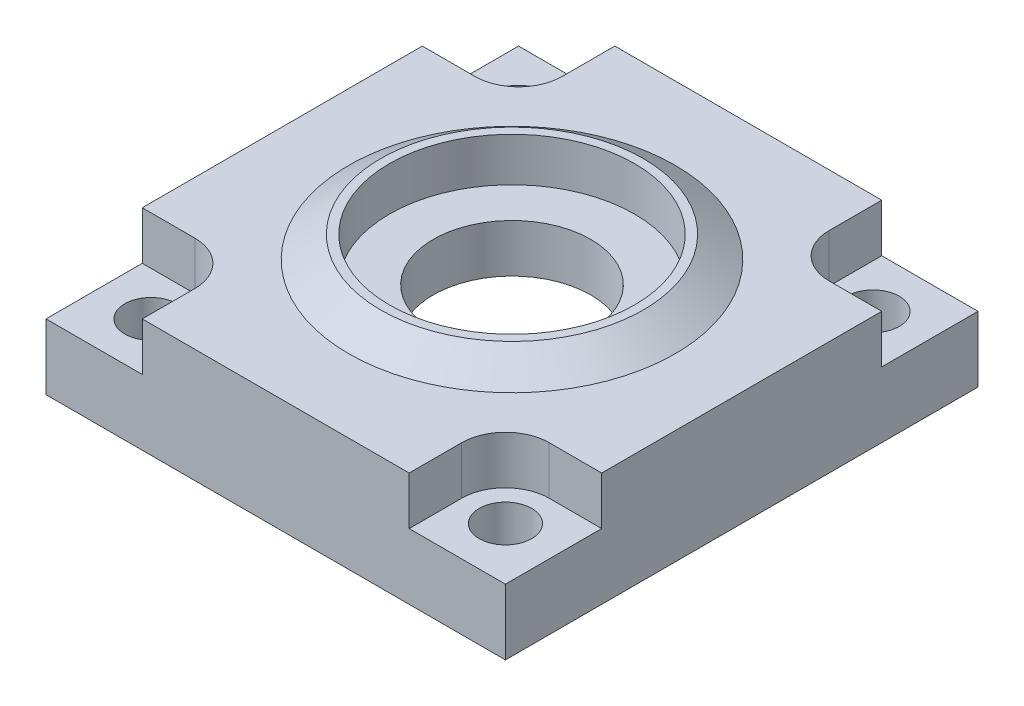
SolidWorks part; units mm, degrees
ref_plane "face" through (0, 0, 0) normal (0, 0, 1) x (1, 0, 0)
ref_plane "dessus" through (0, 0, 0) normal (0, 1, 0) x (1, 0, 0)
ref_plane "profil" through (0, 0, 0) normal (1, 0, 0) x (0, 0, -1)
sketch "Esquisse1" plane through (0, 0, 0) normal (0, 0, 1) x (1, 0, 0)
  line L1 (0, 0) -> (52.5, 0)
  line L2 (0, 0) -> (0, 13)
  line L3 (0, 13) -> (52.5, 13)
  line L4 (52.5, 0) -> (52.5, 13)
  dimension "D1" = 52.5
  dimension "D2" = 13
extrude "Base-Extrusion" add sketch "Esquisse1" against normal blind 54
ref_plane "Plan1" through (0, 0, -27) normal (0, 0, 1) x (1, 0, 0)
ref_plane "Plan2" through (26.25, 0, 0) normal (1, 0, 0) x (0, 0, -1)
sketch "Esquisse2" plane through (0, 0, -27) normal (0, 0, 1) x (1, 0, 0)
  line L0 (26.25, 16.4937) -> (26.25, -1.717) construction
  line L1 (0, 13) -> (0, 0) construction
  line L2 (52.5, 13) -> (0, 13) construction
  line L3 (7.5993, 13) -> (26.25, 13)
  line L5 (11.25, 15.5) -> (26.25, 15.5)
  line L6 (26.25, 15.5) -> (26.25, 13)
  line L8 (11.25, 15.5) -> (7.5993, 13)
  dimension "D1" = 26.25
  dimension "D2" = 15
  dimension "D3" = 2.5
  dimension "D4" = 145.597
revolve "Boss.-Révol.1" add sketch "Esquisse2" angle 360 about L0
sketch "Esquisse3" plane through (0, 0, -27) normal (0, 0, 1) x (1, 0, 0)
  line L0 (26.25, 17.1514) -> (26.25, -1.717) construction
  line L1 (26.25, 16.4937) -> (26.25, -1.717) construction
  line L3 (40.25, 15.5) -> (40.25, 10.5)
  line L4 (41.25, 15.5) -> (11.25, 15.5) construction
  line L5 (40.25, 10.5) -> (35.25, 10.5)
  line L6 (35.25, 10.5) -> (35.25, 5)
  line L7 (35.25, 5) -> (44.75, 5)
  line L8 (44.75, 5) -> (44.75, 0)
  line L9 (0, 0) -> (52.5, 0) construction
  line L10 (44.75, 0) -> (26.25, 0)
  line L11 (26.25, 0) -> (26.25, 15.5)
  line L12 (26.25, 15.5) -> (40.25, 15.5)
  dimension "D1" = 14
  dimension "D2" = 5
  dimension "D3" = 9
  dimension "D4" = 5
  dimension "D5" = 18.5
revolve "Enlèvement de matière-Révolution1" cut sketch "Esquisse3" angle 360 about L0
sketch "Esquisse6" plane through (0, 13, 0) normal (0, 1, 0) x (-1, 0, 0)
  line L1 (0, 0) -> (-11, 0)
  line L2 (0, 0) -> (0, -11)
  line L3 (0, -11) -> (-11, -11)
  line L4 (-11, 0) -> (-11, -11)
  dimension "D1" = 11
  dimension "D2" = 11
extrude "Enlèv. mat.-Extru.3" cut sketch "Esquisse6" against normal blind 5.5
fillet "Congé2" radius 5
sketch "Esquisse7" plane through (0, 7.5, 0) normal (0, 1, 0) x (-1, 0, 0)
  line L0 (0, -11) -> (0, 0) construction
  line L1 (0, 0) -> (-11, 0) construction
  circle A0 centre (-6, -6) radius 3
  dimension "D3" = 6
  dimension "D1" = 6
  dimension "D2" = 6
extrude "Enlèv. mat.-Extru.4" cut sketch "Esquisse7" against normal through all
mirror "Symétrie1" about plane through (26.25, 0, 0) normal (1, 0, 0)
mirror "Symétrie2" about plane through (0, 0, -27) normal (0, 0, 1)
